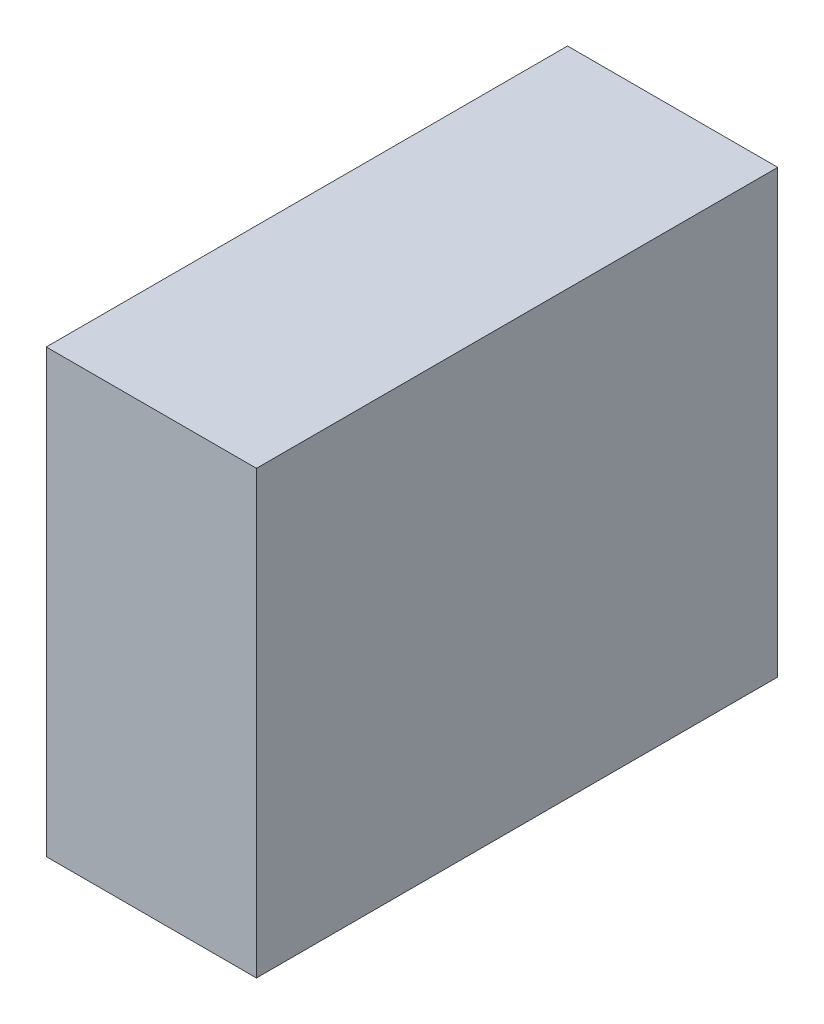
SolidWorks part; units mm, degrees
ref_plane "Front" through (0, 0, 0) normal (0, 0, 1) x (1, 0, 0)
ref_plane "Top" through (0, 0, 0) normal (0, 1, 0) x (1, 0, 0)
ref_plane "Right" through (0, 0, 0) normal (1, 0, 0) x (0, 0, -1)
sketch "Sketch1" plane through (0, 0, 0) normal (0, 1, 0) x (1, 0, 0)
  line L0 (25, -62) -> (-25, 62) construction
  line L1 (-25, 62) -> (25, 62)
  line L2 (-25, 62) -> (-25, -62)
  line L3 (-25, -62) -> (25, -62)
  line L4 (25, 62) -> (25, -62)
  dimension "D1" = 50
  dimension "D2" = 124
extrude "Extrude1" add sketch "Sketch1" along normal blind 105
